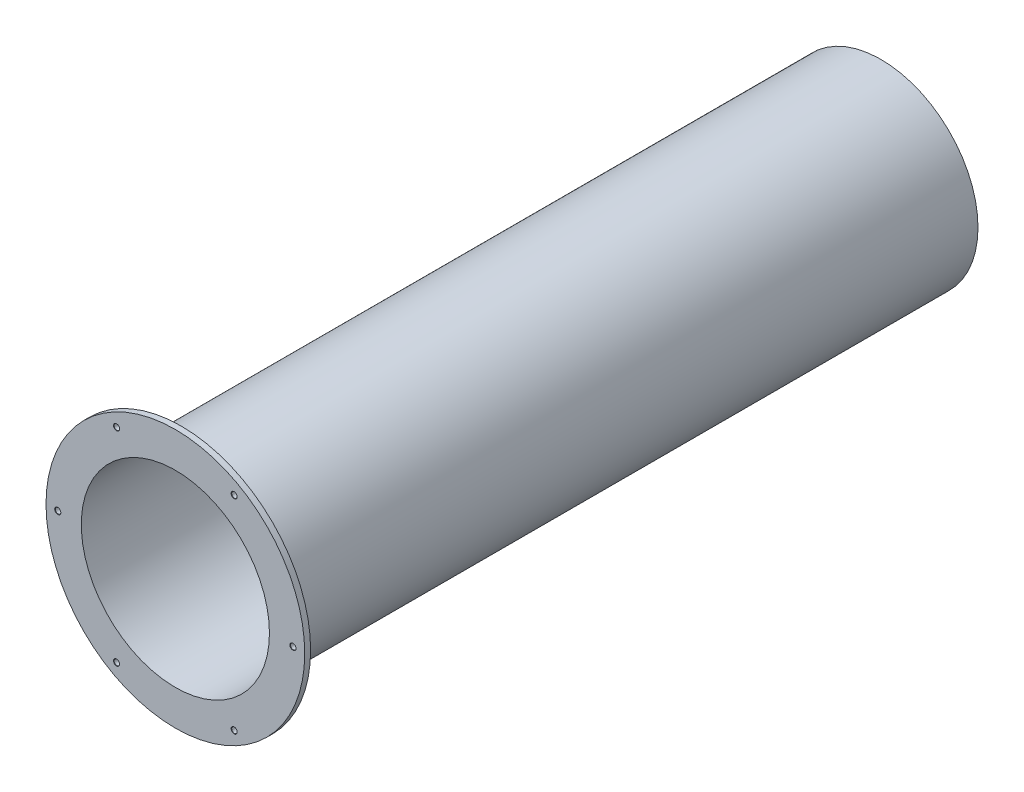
SolidWorks part; units mm, degrees
ref_plane "Front" through (0, 0, 0) normal (0, 0, 1) x (1, 0, 0)
ref_plane "Top" through (0, 0, 0) normal (0, 1, 0) x (1, 0, 0)
ref_plane "Right" through (0, 0, 0) normal (1, 0, 0) x (0, 0, -1)
sketch "Sketch1" plane through (0, 0, 0) normal (0, 0, 1) x (1, 0, 0)
  circle A0 centre (0, 0) radius 279.4
  circle A1 centre (0, 0) radius 203.2
  dimension "D1" = 558.8
  dimension "D2" = 406.4
extrude "Boss-Extrude1" add sketch "Sketch1" along normal blind 12.7
sketch "Sketch2" plane through (0, 0, 12.7) normal (0, 0, 1) x (1, 0, 0)
  circle A0 centre (0, 0) radius 203.2
  circle A1 centre (0, 0) radius 209.55
  dimension "D1" = 6.35
extrude "Boss-Extrude2" add sketch "Sketch2" against normal blind 1524
hole_wizard "15/32 (0.46875) Diameter Hole1" positions "Sketch3" profile "Sketch4" hole size "15/32" standard "ANSI Inch"
sketch "Sketch3" plane through (0, 0, 12.7) normal (0, 0, 1) x (1, 0, 0)
  point P0 (254, 0)
  point P10 (127, -219.9705)
  point P11 (-127, -219.9705)
  point P12 (-254, 0)
  point P13 (-127, 219.9705)
  point P14 (127, 219.9705)
  dimension "D1" = 254
  dimension "D2" = 6
sketch "Sketch4" plane through (254, 0, 12.7) normal (1, 0, 0) x (0, -1, 0)
  line L0 (0, 0) -> (0, 12.7)
  line L1 (0, 12.7) -> (6.5881, 12.7)
  line L2 (5.9531, 12.065) -> (5.9531, 0.635)
  line L3 (5.9531, 0.635) -> (6.5881, 0)
  line L5 (6.5881, 0) -> (0, 0)
  line L6 (-5.9531, 0.635) -> (-6.5881, 0) construction
  line L7 (6.5881, 12.7) -> (5.9531, 12.065)
  line L8 (-6.5881, 12.7) -> (-5.9531, 12.065) construction
  line L11 (0, -6.35) -> (0, 107.95) construction
  dimension "Thru Hole Dia." = 11.9062
  dimension "Thru Hole Depth" = 12.7
  dimension "Near C'Sink Dia." = 13.1762
  dimension "Near C'Sink Angle" = 90
  dimension "Far C'Sink Dia." = 13.1762
  dimension "Far C'Sink Angle" = 90
